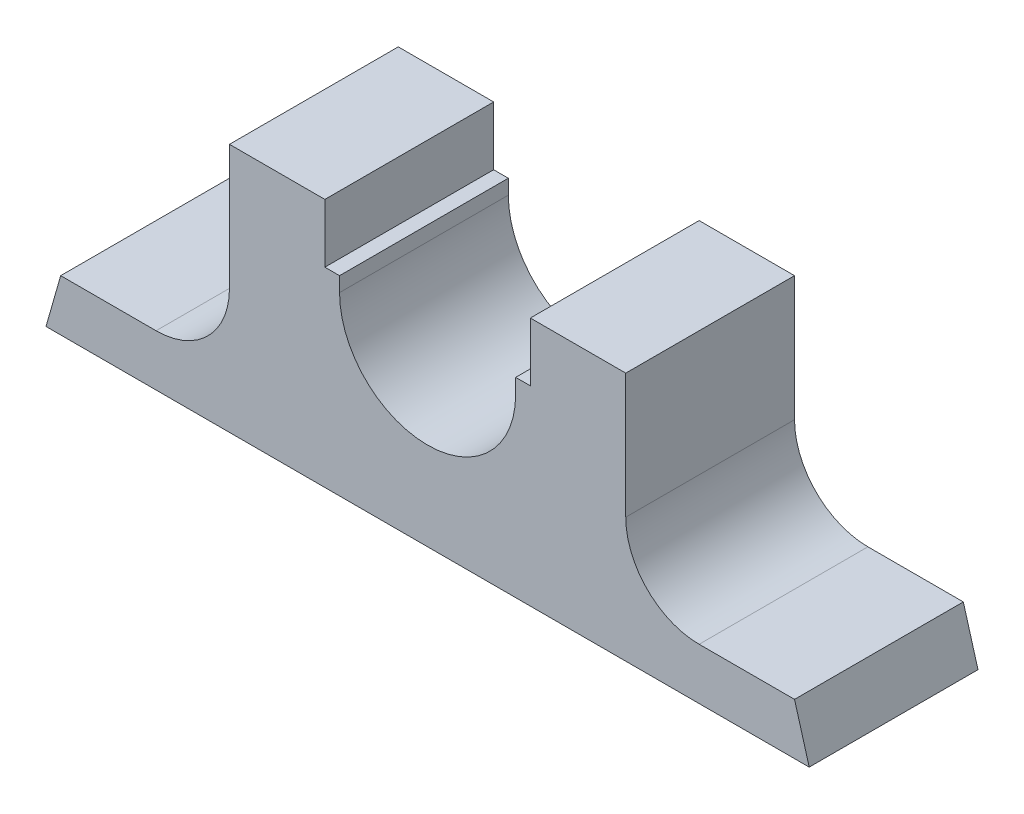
SolidWorks part; units mm, degrees
ref_plane "Front" through (0, 0, 0) normal (0, 0, 1) x (1, 0, 0)
ref_plane "Top" through (0, 0, 0) normal (0, 1, 0) x (1, 0, 0)
ref_plane "Right" through (0, 0, 0) normal (1, 0, 0) x (0, 0, -1)
sketch "Sketch1" plane through (0, 0, 0) normal (0, 0, 1) x (1, 0, 0)
  line L0 (-104, 0) -> (104, 0)
  line L1 (0, 91.4502) -> (0, -4.8887) construction
  line L2 (104, 0) -> (100, 14)
  line L3 (-104, 0) -> (-100, 14)
  line L4 (100, 14) -> (54, 14)
  line L5 (-100, 14) -> (-54, 14)
  line L6 (54, 14) -> (54, 68)
  line L7 (-54, 14) -> (-54, 68)
  line L8 (54, 68) -> (28, 68)
  line L9 (-54, 68) -> (-28, 68)
  line L10 (28, 68) -> (28, 52)
  line L11 (-28, 68) -> (-28, 52)
  line L12 (28, 52) -> (24, 52)
  line L13 (-28, 52) -> (-24, 52)
  line L14 (24, 52) -> (24, 48)
  line L15 (-24, 52) -> (-24, 48)
  arc A0 (24, 48) -> (0, 24) centre (0, 48) cw
  arc A1 (-24, 48) -> (0, 24) centre (0, 48) ccw
  dimension "D7" = 48
  dimension "D1" = 208
  dimension "D2" = 4
  dimension "D3" = 14
  dimension "D4" = 56
  dimension "D5" = 16
  dimension "D6" = 4
  dimension "D8" = 68
  dimension "D9" = 54
extrude "Extrude1" add sketch "Sketch1" along normal mid plane 46
fillet "Fillet1" radius 20
other "DeleteFace1"
